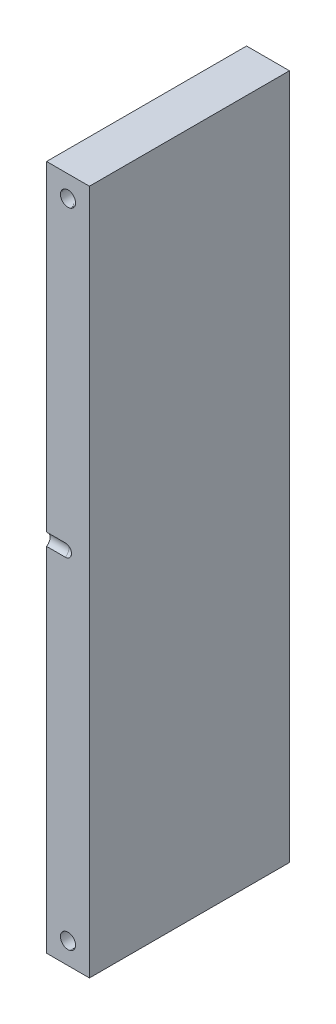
SolidWorks part; units mm, degrees
ref_plane "Front" through (0, 0, 0) normal (0, 0, 1) x (1, 0, 0)
ref_plane "Top" through (0, 0, 0) normal (0, 1, 0) x (1, 0, 0)
ref_plane "Right" through (0, 0, 0) normal (1, 0, 0) x (0, 0, -1)
sketch "Sketch1" plane through (0, 0, 0) normal (0, 0, 1) x (1, 0, 0)
  line L0 (-1219.2, -304.8) -> (0, -304.8) construction
  line L1 (-228.6, 304.8) -> (-266.7, 304.8)
  line L2 (-228.6, 304.8) -> (-228.6, -304.8)
  line L3 (-228.6, -304.8) -> (-266.7, -304.8)
  line L4 (-266.7, 304.8) -> (-266.7, -304.8)
  line L5 (0, 304.8) -> (-1219.2, 304.8) construction
  line L6 (-50.8, 304.8) -> (-50.8, -304.8) construction
  dimension "D1" = 38.1
  dimension "D2" = 177.8
extrude "Boss-Extrude1" add sketch "Sketch1" along normal blind 177.8 separate body
ref_plane "Plane1" through (-247.65, 0, 0) normal (1, 0, 0) x (0, 0, -1)
hole_wizard "Hole1" positions "Point_Sketch" profile "Profil_Sketch" tap size "5/8-11" standard "ANSI Inch"
sketch "Point_Sketch" plane through (-261.8635, -301.9822, 177.8) normal (0, 0, 1) x (1, 0, 0)
  point P0 (14.2135, 16.2322)
  point P2 (14.2135, 587.7322)
sketch "Profil_Sketch" plane through (-247.65, -285.75, 177.8) normal (1, 0, 0) x (0, -1, 0)
  line L0 (0, 0) -> (0, 59.6803)
  line L1 (0, 59.6803) -> (6.7475, 55.626)
  line L2 (6.7475, 55.626) -> (6.7475, 0)
  line L5 (6.7475, 0) -> (0, 0)
  line L10 (0, 59.6803) -> (-6.7475, 55.626) construction
  line L11 (0, -6.35) -> (0, 107.95) construction
  dimension "Tap Drill Dia." = 13.495
  dimension "Tap Drill Depth" = 55.626
  dimension "Drill Angle" = 118
other "usin_TS240_.625-11x3.5-SHCS<1>"
sketch "Sketch2" plane through (0, 0, 177.8) normal (0, 0, 1) x (1, 0, 0)
  circle A0 centre (-249.428, 13.97) radius 4.7879 construction
  circle A1 centre (-249.428, 13.97) radius 4.7879
sketch "Sketch3" plane through (-266.7, 0, 0) normal (-1, 0, 0) x (0, 0, 1)
  line L0 (151.1491, 13.97) -> (201.7061, 13.97) construction
  line L1 (177.8, 304.8) -> (177.8, -304.8) construction
  circle A0 centre (180.975, 13.97) radius 6.35
  dimension "D1" = 12.7
  dimension "D2" = 3.175
extrude "Cut-Extrude1" cut sketch "Sketch3" against normal blind 22.225
fillet "Fillet1" radius 6.35 1 edges at (-244.475, 13.97, 174.625)
